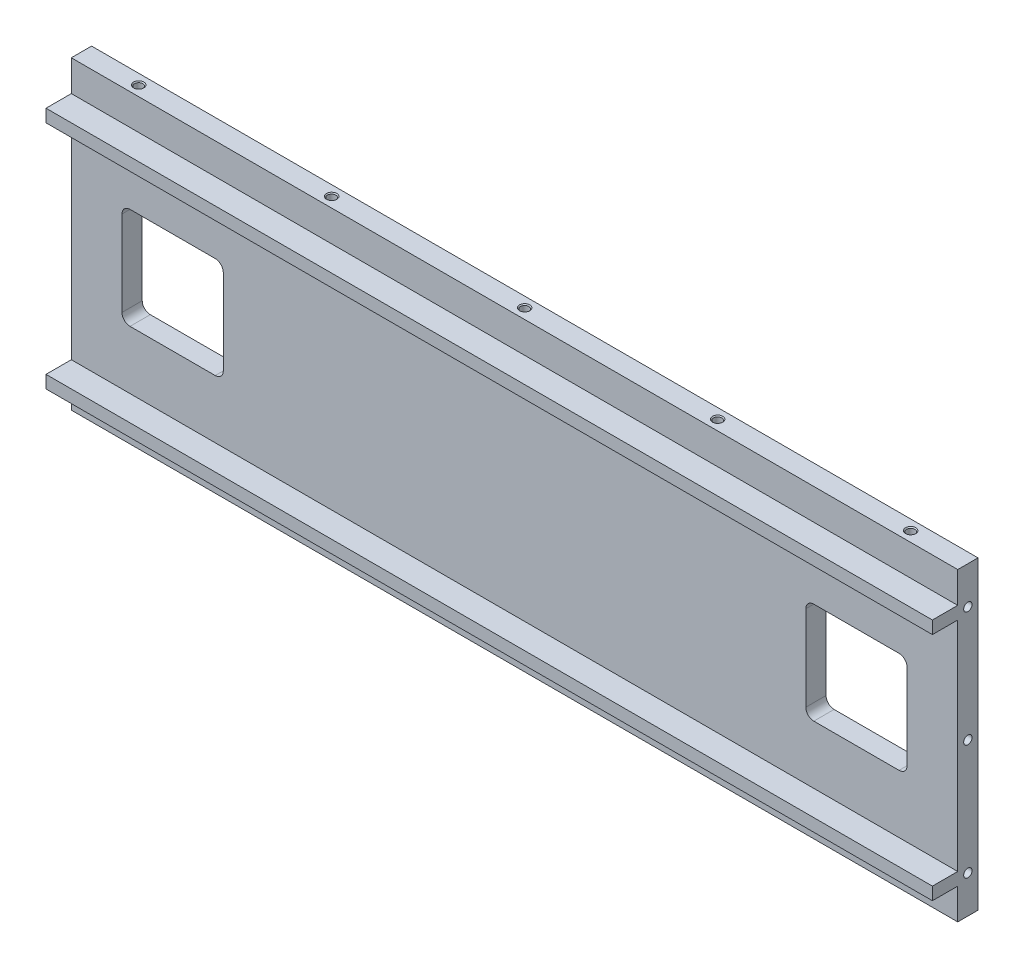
SolidWorks part; units mm, degrees
ref_plane "Front Plane" through (0, 0, 0) normal (0, 0, 1) x (1, 0, 0)
ref_plane "Top Plane" through (0, 0, 0) normal (0, 1, 0) x (1, 0, 0)
ref_plane "Right Plane" through (0, 0, 0) normal (1, 0, 0) x (0, 0, -1)
sketch "Sketch1" plane through (0, 0, 0) normal (0, 0, 1) x (1, 0, 0)
  line L1 (-175, 60.25) -> (175, 60.25)
  line L2 (-175, 60.25) -> (-175, -60.25)
  line L3 (-175, -60.25) -> (175, -60.25)
  line L4 (175, 60.25) -> (175, -60.25)
  point P4 (175, 0)
  point P6 (0, 60.25)
  dimension "D1" = 120.5
  dimension "D2" = 350
extrude "Boss-Extrude1" add sketch "Sketch1" along normal blind 8
sketch "Sketch2" plane through (0, 0, 8) normal (0, 0, 1) x (1, 0, 0)
  line L0 (-175, 60.25) -> (-175, -60.25) construction
  line L1 (-175, 48) -> (175, 48)
  line L2 (-175, 48) -> (-175, 43)
  line L3 (-175, 43) -> (175, 43)
  line L4 (175, 48) -> (175, 43)
  line L5 (175, -60.25) -> (175, 60.25) construction
  dimension "D1" = 5
  dimension "D2" = 43
extrude "Boss-Extrude2" add sketch "Sketch2" along normal blind 10
sketch "Sketch11" plane through (0, 0, 8) normal (0, 0, 1) x (1, 0, 0)
  line L0 (175, -60.25) -> (175, 43) construction
  line L1 (118.175, 20) -> (151.825, 20)
  line L2 (115, 16.825) -> (115, -16.825)
  line L3 (118.175, -20) -> (151.825, -20)
  line L4 (155, 16.825) -> (155, -16.825)
  line L6 (9.9, 0) -> (-9.9, 0) construction
  arc A0 (115, -16.825) -> (118.175, -20) centre (118.175, -16.825) ccw
  arc A1 (151.825, -20) -> (155, -16.825) centre (151.825, -16.825) ccw
  arc A2 (151.825, 20) -> (155, 16.825) centre (151.825, 16.825) cw
  arc A3 (118.175, 20) -> (115, 16.825) centre (118.175, 16.825) ccw
  point P6 (155, 0)
  point P10 (115, -20)
  point P13 (155, -20)
  point P16 (155, 20)
  dimension "D5" = 3.175
  dimension "D1" = 40
  dimension "D2" = 40
  dimension "D3" = 20
extrude "Cut-Extrude1" cut sketch "Sketch11" against normal up to next
hole_wizard "M4x0.7 Tapped Hole2" positions "Sketch12" profile "Sketch13" tap size "M4x0.7" standard "ANSI Metric"
sketch "Sketch12" plane through (0, 60.25, 0) normal (0, 1, 0) x (1, 0, 0)
  line L0 (175, -8) -> (175, 0) construction
  line L1 (175, -8) -> (-175, -8) construction
  point P0 (152.4, -4)
  dimension "D1" = 22.6
  dimension "D2" = 4
sketch "Sketch13" plane through (152.4, 60.25, 4) normal (1, 0, 0) x (0, 0, 1)
  line L0 (0, 0) -> (0, 14.9914)
  line L1 (0, 14.9914) -> (1.65, 14)
  line L2 (1.65, 14) -> (1.65, 0.375)
  line L3 (1.65, 0.375) -> (2.025, 0)
  line L5 (2.025, 0) -> (0, 0)
  line L6 (-1.65, 0.375) -> (-2.025, 0) construction
  line L10 (0, 14.9914) -> (-1.65, 14) construction
  line L11 (0, -6.35) -> (0, 107.95) construction
  dimension "Tap Drill Dia." = 3.3
  dimension "Tap Drill Depth" = 14
  dimension "Near C'Sink Dia." = 4.05
  dimension "Near C'Sink Angle" = 90
  dimension "Drill Angle" = 118
pattern_linear "LPattern4" count 5 spacing 76.2 along (-1, 0, 0) of "M4x0.7 Tapped Hole2"
mirror "Mirror4" about plane through (0, 0, 0) normal (0, 1, 0) of "LPattern4", "M4x0.7 Tapped Hole2", "Boss-Extrude2"
hole_wizard "M4x0.7 Tapped Hole1" positions "Sketch8" profile "Sketch10" tap size "M4x0.7" standard "ANSI Metric"
sketch "Sketch8" plane through (175, 0, 0) normal (1, 0, 0) x (0, 0, -1)
  line L0 (0, -60.25) -> (0, 60.25) construction
  point P0 (-4, 0)
  point P7 (0, 0)
  dimension "D1" = 4
sketch "Sketch10" plane through (175, 0, 4) normal (0, 1, 0) x (0, 0, -1)
  line L0 (0, 0) -> (0, 14.9914)
  line L1 (0, 14.9914) -> (1.65, 14)
  line L2 (1.65, 14) -> (1.65, 0)
  line L5 (1.65, 0) -> (0, 0)
  line L10 (0, 14.9914) -> (-1.65, 14) construction
  line L11 (0, -6.35) -> (0, 107.95) construction
  dimension "Tap Drill Dia." = 3.3
  dimension "Tap Drill Depth" = 14
  dimension "Drill Angle" = 118
pattern_linear "LPattern3" count 2 spacing 45.5 along (0, 1, 0) count 2 spacing 45.5 along (0, -1, 0) of "M4x0.7 Tapped Hole1"
mirror "Mirror2" about plane through (0, 0, 0) normal (1, 0, 0) of "LPattern3", "M4x0.7 Tapped Hole1", "Cut-Extrude1"
